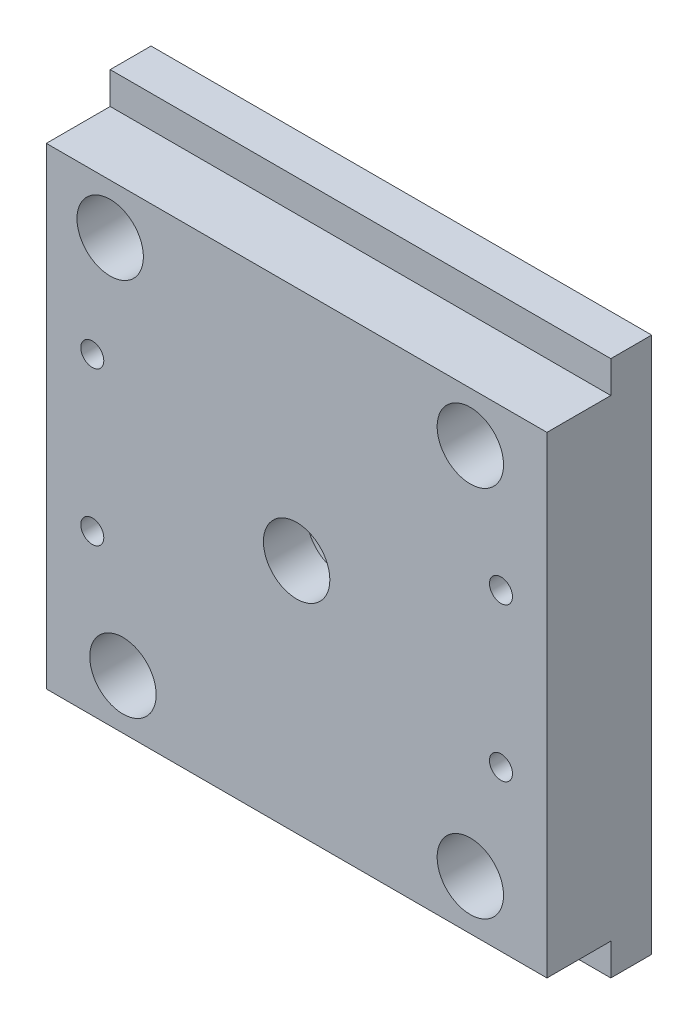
SolidWorks part; units mm, degrees
ref_plane "Plan de face" through (0, 0, 0) normal (0, 0, 1) x (1, 0, 0)
ref_plane "Plan de dessus" through (0, 0, 0) normal (0, 1, 0) x (1, 0, 0)
ref_plane "Plan de droite" through (0, 0, 0) normal (1, 0, 0) x (0, 0, -1)
sketch "Esquisse1" plane through (0, 0, 0) normal (0, 0, 1) x (1, 0, 0)
  line L1 (0, 0) -> (196, 0)
  line L2 (0, 0) -> (0, 210)
  line L3 (0, 210) -> (196, 210)
  line L4 (196, 0) -> (196, 210)
  dimension "D1" = 210
  dimension "D2" = 196
extrude "Extrusion1" add sketch "Esquisse1" along normal blind 16
sketch "Esquisse2" plane through (0, 0, 16) normal (0, 0, 1) x (1, 0, 0)
  line L0 (0, 210) -> (0, 0) construction
  line L1 (0, 197.5) -> (196, 197.5)
  line L2 (0, 197.5) -> (0, 12.5)
  line L3 (0, 12.5) -> (196, 12.5)
  line L4 (196, 197.5) -> (196, 12.5)
  line L5 (196, 0) -> (196, 210) construction
  line L7 (196, 210) -> (0, 210) construction
  dimension "D1" = 185
  dimension "D2" = 12.5
extrude "Extrusion2" add sketch "Esquisse2" along normal blind 25
sketch "Esquisse3" plane through (0, 0, 0) normal (0, 0, -1) x (-1, 0, 0)
  line L0 (-98, 210) -> (-98, 0) construction
  line L1 (-196, 210) -> (0, 210) construction
  line L2 (0, 0) -> (-196, 0) construction
  line L3 (-196, 105) -> (0, 105) construction
  line L4 (-196, 0) -> (-196, 210) construction
  line L5 (0, 210) -> (0, 0) construction
  line L6 (-214.75, 178) -> (45.0645, 178) construction
  line L7 (-218.7232, 32) -> (22.112, 32) construction
  line L8 (-166, 220.8332) -> (-166, -13.5838) construction
  line L9 (-25, 217.4713) -> (-25, -13.5838) construction
  line L10 (-30, 58.141) -> (-30, 3.3602) construction
  circle A0 centre (-25, 178) radius 13
  circle A1 centre (-166, 178) radius 13
  circle A2 centre (-166, 32) radius 13
  circle A3 centre (-30, 32) radius 13
  circle A4 centre (-18, 75) radius 4.5
  circle A5 centre (-18, 135) radius 4.5
  circle A6 centre (-178, 75) radius 4.5
  circle A7 centre (-178, 135) radius 4.5
  circle A8 centre (-98, 105) radius 13
  dimension "D6" = 30
  dimension "D7" = 30
  dimension "D9" = 30
  dimension "D10" = 80
  dimension "D11" = 80
  dimension "D12" = 80
  dimension "D13" = 80
  dimension "D14" = 9
  dimension "D15" = 9
  dimension "D16" = 9
  dimension "D17" = 9
  dimension "D18" = 26
  dimension "D19" = 26
  dimension "D20" = 26
  dimension "D21" = 26
  dimension "D1" = 73
  dimension "D2" = 73
  dimension "D3" = 68
  dimension "D4" = 73
  dimension "D5" = 68
  dimension "D8" = 30
extrude "Enlèv. mat.-Extru.1" cut sketch "Esquisse3" against normal through all
sketch "Esquisse4" plane through (0, 0, 0) normal (0, 0, -1) x (-1, 0, 0)
  circle A0 centre (-98, 105) radius 26
  circle A1 centre (-98, 105) radius 13 construction
  dimension "D1" = 52
extrude "Enlèv. mat.-Extru.2" cut sketch "Esquisse4" against normal blind 24
sketch "Esquisse5" plane through (0, 0, 0) normal (0, 0, -1) x (-1, 0, 0)
  circle A0 centre (-98, 105) radius 45
  circle A1 centre (-98, 105) radius 26 construction
  dimension "D1" = 90
extrude "Enlèv. mat.-Extru.3" cut sketch "Esquisse5" against normal blind 4
sketch "Esquisse6" plane through (0, 0, 0) normal (0, 0, -1) x (-1, 0, 0)
  circle A0 centre (-18, 135) radius 8
  circle A1 centre (-18, 75) radius 8
  circle A2 centre (-178, 75) radius 8
  circle A3 centre (-178, 135) radius 8
  circle A4 centre (-18, 135) radius 4.5 construction
  circle A5 centre (-18, 75) radius 4.5 construction
  circle A6 centre (-178, 75) radius 4.5 construction
  circle A7 centre (-178, 135) radius 4.5 construction
  dimension "D1" = 16
  dimension "D2" = 16
  dimension "D3" = 16
  dimension "D4" = 16
extrude "Enlèv. mat.-Extru.4" cut sketch "Esquisse6" against normal blind 9
sketch "Esquisse7" plane through (0, 0, 0) normal (0, 0, -1) x (-1, 0, 0)
  circle A0 centre (-30, 32) radius 16.5
  circle A1 centre (-166, 32) radius 16.5
  circle A2 centre (-166, 178) radius 16.5
  circle A3 centre (-25, 178) radius 16.5
  circle A4 centre (-25, 178) radius 13 construction
  circle A5 centre (-30, 32) radius 13 construction
  circle A6 centre (-166, 32) radius 13 construction
  circle A7 centre (-166, 178) radius 13 construction
  dimension "D1" = 33
  dimension "D2" = 33
  dimension "D3" = 33
  dimension "D4" = 33
extrude "Enlèv. mat.-Extru.5" cut sketch "Esquisse7" against normal blind 6.3
hole_wizard "Trou taraudé M6x1.01" positions "Esquisse9" profile "Esquisse8" tap size "M6x1.0" standard "ISO"
sketch "Esquisse9" plane through (0, 0, 0) normal (0, 0, -1) x (-1, 0, 0)
  line L0 (-196, 105) -> (0, 105) construction
  line L1 (-196, 0) -> (-196, 210) construction
  line L2 (0, 210) -> (0, 0) construction
  line L3 (-98, 210) -> (-98, 0) construction
  line L4 (-196, 210) -> (0, 210) construction
  line L5 (0, 0) -> (-196, 0) construction
  point P0 (-63, 105)
  point P1 (-133, 105)
  dimension "D1" = 35
  dimension "D2" = 35
sketch "Esquisse8" plane through (63, 105, 0) normal (1, 0, 0) x (0, 1, 0)
  line L0 (0, 0) -> (0, 18.5022)
  line L1 (0, 18.5022) -> (2.5, 17)
  line L2 (2.5, 17) -> (2.5, 0)
  line L5 (2.5, 0) -> (0, 0)
  line L10 (0, 18.5022) -> (-2.5, 17) construction
  line L11 (0, -6.35) -> (0, 107.95) construction
  dimension "Diamètre du trou pour taraudage" = 5
  dimension "Profondeur du trou pour taraudage" = 17
  dimension "Angle de pointe" = 118
sketch "Esquisse10" plane through (0, 0, 4) normal (0, 0, -1) x (-1, 0, 0)
  line L0 (-98, 105) -> (-98, 157.0189) construction
  line L1 (-101, 129.8193) -> (-101, 120) construction
  line L2 (-101, 126.0257) -> (-95, 126.0257)
  line L3 (-101, 126.0257) -> (-101, 145)
  line L4 (-101, 145) -> (-95, 145)
  line L5 (-95, 126.0257) -> (-95, 145)
  dimension "D1" = 6
  dimension "D2" = 40
extrude "Enlèv. mat.-Extru.6" cut sketch "Esquisse10" against normal blind 15
fillet "Congé1" radius 3 4 edges at (95, 137.9132, 19) (101, 137.9132, 19) (95, 145, 11.5) (101, 145, 11.5)
